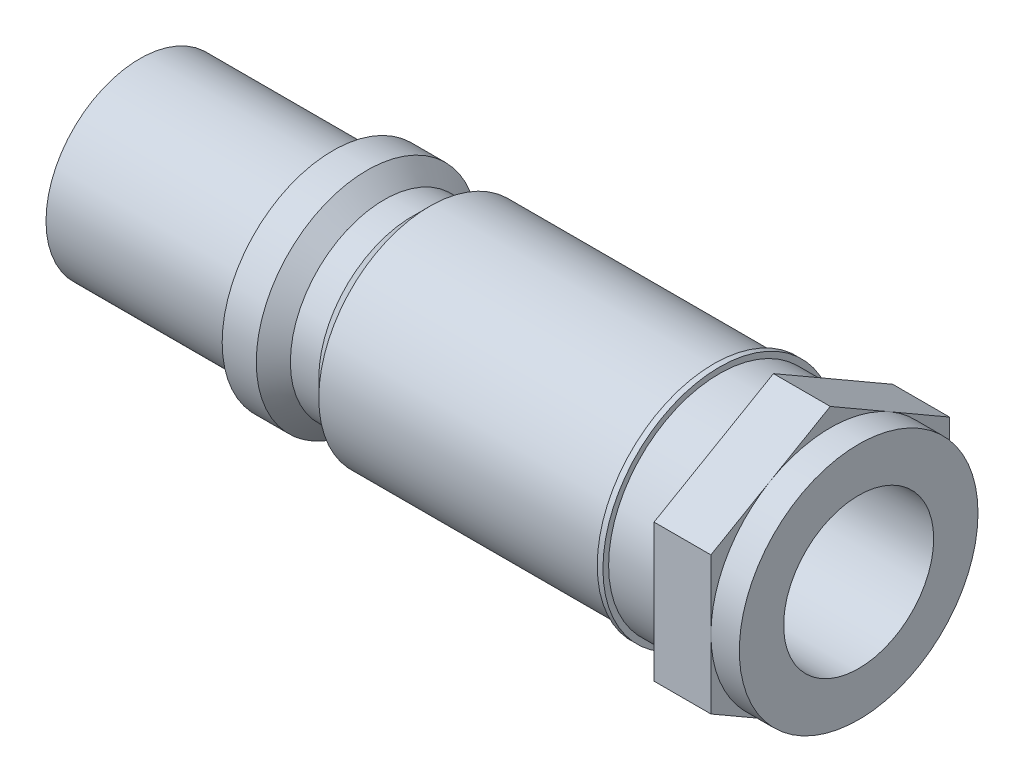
SolidWorks part; units mm, degrees
ref_plane "Alzado" through (0, 0, 0) normal (0, 0, 1) x (1, 0, 0)
ref_plane "Planta" through (0, 0, 0) normal (0, 1, 0) x (1, 0, 0)
ref_plane "Vista lateral" through (0, 0, 0) normal (1, 0, 0) x (0, 0, -1)
sketch "Croquis1" plane through (0, 0, 0) normal (0, 0, 1) x (1, 0, 0)
  line L0 (0, 0) -> (111.5, 0) construction
  line L1 (0, 0) -> (0, 16.5)
  line L2 (0, 16.5) -> (34, 16.5)
  line L3 (34, 16.5) -> (34, 19.5)
  line L4 (34, 19.5) -> (40, 19.5)
  line L5 (40, 19.5) -> (43, 16.5)
  line L6 (43, 16.5) -> (48, 16.5)
  line L7 (48, 16.5) -> (51, 19.5)
  line L11 (111.5, 19.5) -> (111.5, 0)
  line L12 (0, 0) -> (111.5, 0)
  line L13 (51, 19.5) -> (101, 19.5)
  line L14 (101, 19.5) -> (101, 20.5)
  line L15 (101, 20.5) -> (102, 20.5)
  line L16 (102, 20.5) -> (102, 19.5)
  line L17 (102, 19.5) -> (111.5, 19.5)
  dimension "D1" = 33
  dimension "D2" = 111.5
  dimension "D3" = 50
  dimension "D4" = 1
  dimension "D5" = 34
  dimension "D6" = 6
  dimension "D7" = 3
  dimension "D8" = 5
  dimension "D9" = 225
  dimension "D10" = 1
  dimension "D11" = 9.5
revolve "Revolución1" add sketch "Croquis1" angle 360 about L0
sketch "Croquis4" plane through (111.5, 0, 0) normal (1, 0, 0) x (0, 0, -1)
  line L1 (0, 24.2487) -> (-21, 12.1244)
  line L2 (-21, 12.1244) -> (-21, -12.1244)
  line L3 (-21, -12.1244) -> (0, -24.2487)
  line L4 (0, -24.2487) -> (21, -12.1244)
  line L5 (21, -12.1244) -> (21, 12.1244)
  line L6 (21, 12.1244) -> (0, 24.2487)
  circle A0 centre (0, 0) radius 21 construction
  dimension "D1" = 42
extrude "Saliente-Extruir2" add sketch "Croquis4" along normal blind 10
sketch "Croquis5" plane through (121.5, 0, 0) normal (1, 0, 0) x (0, 0, -1)
  circle A0 centre (0, 0) radius 21
  dimension "D1" = 42
extrude "Saliente-Extruir3" add sketch "Croquis5" along normal blind 5
sketch "Croquis6" plane through (126.5, 0, 0) normal (1, 0, 0) x (0, 0, -1)
  circle A0 centre (0, 0) radius 13.2
  dimension "D1" = 26.4
extrude "Cortar-Extruir2" cut sketch "Croquis6" against normal through all
